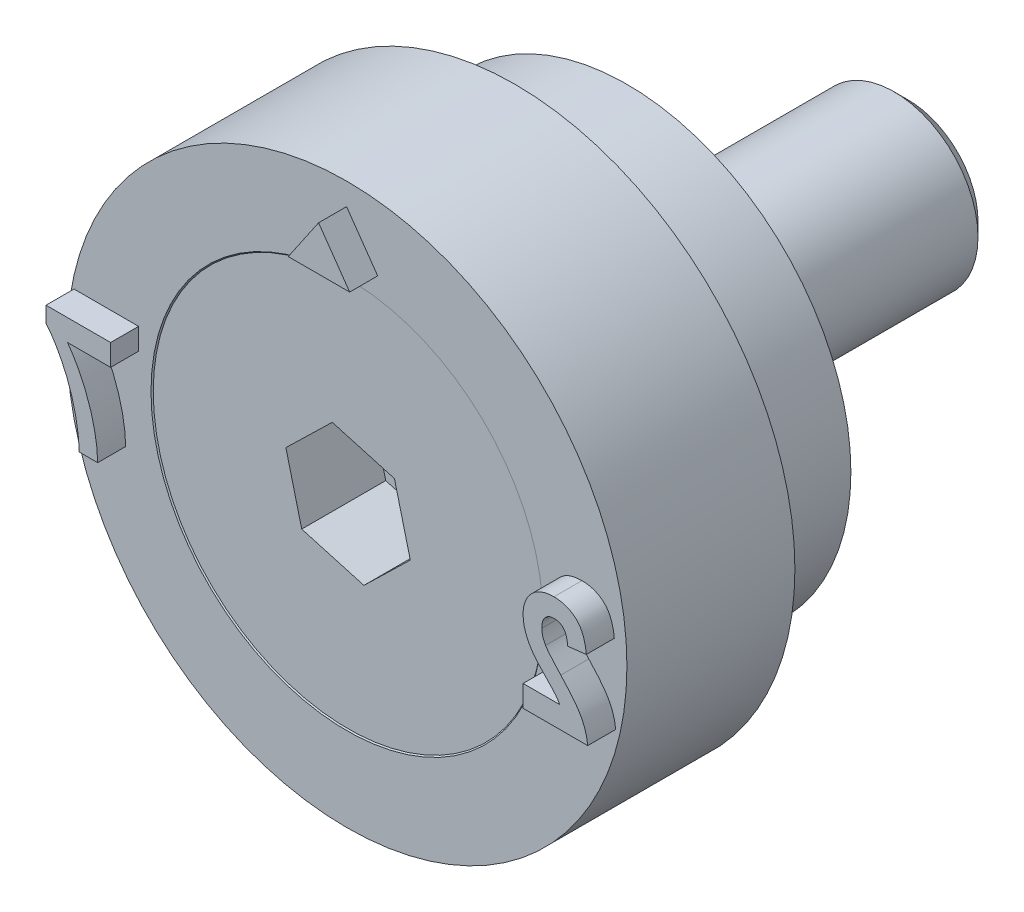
SolidWorks part; units mm, degrees
other "<M3 X .5 FHCS>-<Imported1>"
ref_plane "Front Plane" through (0, 0, 0) normal (0, 0, 1) x (1, 0, 0)
ref_plane "Top Plane" through (0, 0, 0) normal (0, 1, 0) x (1, 0, 0)
ref_plane "Right Plane" through (0, 0, 0) normal (1, 0, 0) x (0, 0, -1)
imported_body "Imported1"
sketch "Sketch1" plane through (0, 0, 0) normal (0, 0, 1) x (1, 0, 0)
  line L0 (-0.0071, 4.6037) -> (-0.5487, 3.81)
  line L1 (-0.5487, 3.81) -> (0.5487, 3.81)
  line L2 (0.5487, 3.81) -> (-0.0071, 4.6037)
  text T0 "2             7" font "Arial" height 2
  dimension "D1" = 1.0795
  dimension "D2" = 4.9022
extrude "Boss-Extrude1" add sketch "Sketch1" along normal blind 0.5 and the other way up to surface
inserted part "M3 X .5 FHCS"
move or copy body "Body-Move/Copy2" placed by mates yes
